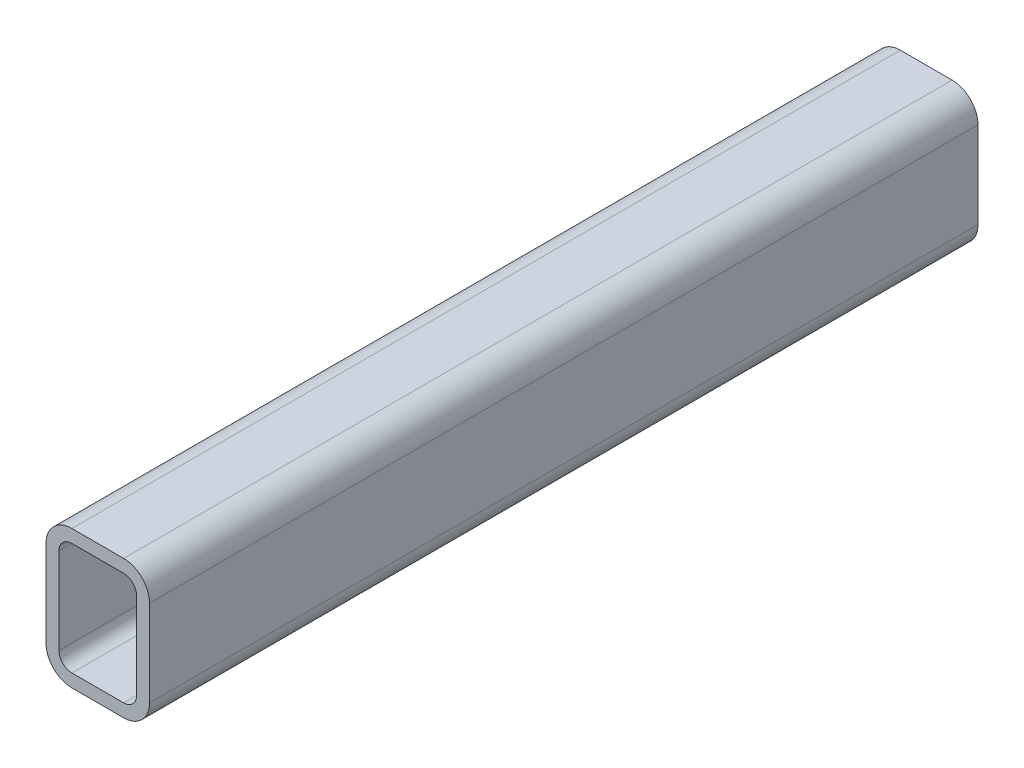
SolidWorks part; units mm, degrees
ref_plane "Front Plane" through (0, 0, 0) normal (0, 0, 1) x (1, 0, 0)
ref_plane "Top Plane" through (0, 0, 0) normal (0, 1, 0) x (1, 0, 0)
ref_plane "Right Plane" through (0, 0, 0) normal (1, 0, 0) x (0, 0, -1)
sketch "Sketch1" plane through (0, 0, 0) normal (0, 0, 1) x (1, 0, 0)
  line B0 (9.525, 50.8) -> (28.575, 50.8)
  arc B1 (38.1, 41.275) -> (28.575, 50.8) centre (28.575, 41.275) ccw
  line B2 (38.1, 41.275) -> (38.1, 9.525)
  arc B3 (28.575, 0) -> (38.1, 9.525) centre (28.575, 9.525) ccw
  line B4 (28.575, 0) -> (9.525, 0)
  arc B5 (0, 9.525) -> (9.525, 0) centre (9.525, 9.525) ccw
  line B6 (0, 9.525) -> (0, 41.275)
  arc B7 (9.525, 50.8) -> (0, 41.275) centre (9.525, 41.275) ccw
  line B8 (9.525, 46.0375) -> (28.575, 46.0375)
  arc B9 (33.3375, 41.275) -> (28.575, 46.0375) centre (28.575, 41.275) ccw
  line B10 (33.3375, 41.275) -> (33.3375, 9.525)
  arc B11 (28.575, 4.7625) -> (33.3375, 9.525) centre (28.575, 9.525) ccw
  line B12 (28.575, 4.7625) -> (9.525, 4.7625)
  arc B13 (4.7625, 9.525) -> (9.525, 4.7625) centre (9.525, 9.525) ccw
  line B14 (4.7625, 9.525) -> (4.7625, 41.275)
  arc B15 (9.525, 46.0375) -> (4.7625, 41.275) centre (9.525, 41.275) ccw
sketch_block_instance "HSS2x1.5x0.1875-1"
sketch_block "HSS2x1.5x0.1875"
extrude "Boss-Extrude1" add sketch "Sketch1" along normal blind 304.8
